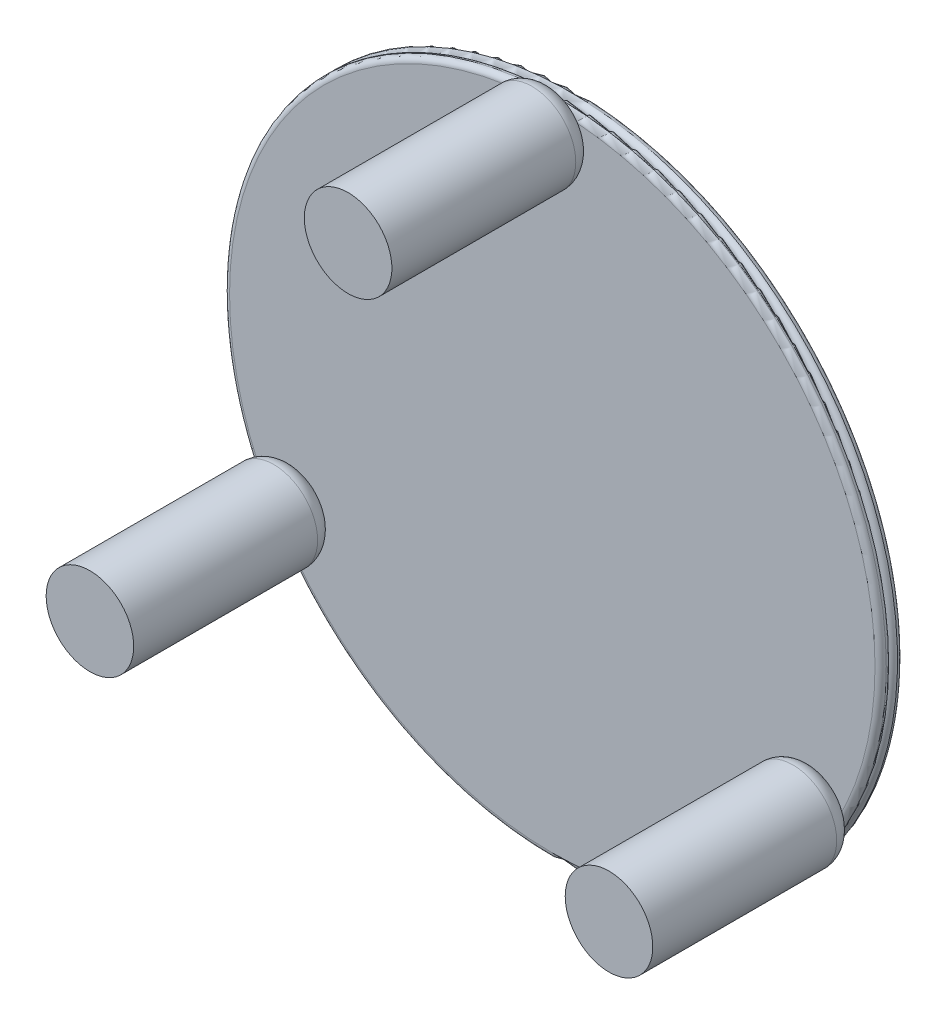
SolidWorks part; units mm, degrees
ref_plane "Front Plane" through (0, 0, 0) normal (0, 0, 1) x (1, 0, 0)
ref_plane "Top Plane" through (0, 0, 0) normal (0, 1, 0) x (1, 0, 0)
ref_plane "Right Plane" through (0, 0, 0) normal (1, 0, 0) x (0, 0, -1)
sketch "Sketch2" plane through (0, 0, 0) normal (0, 0, 1) x (1, 0, 0)
  circle A1 centre (-266.1198, 33.5976) radius 525
  dimension "D2" = 1050
extrude "Boss-Extrude1" add sketch "Sketch2" along normal blind 18
fillet "Fillet1" radius 9 2 edges at (258.8802, 33.5976, 0) (258.8802, 33.5976, 18)
sketch "Sketch3" plane through (0, 0, 0) normal (0, 0, -1) x (-1, 0, 0)
  circle A0 centre (266.1198, 33.5976) radius 525 construction
  circle A1 centre (266.1198, 33.5976) radius 525
extrude "Boss-Extrude2" add sketch "Sketch3" along normal blind 18 separate body
fillet "Fillet2" radius 9 2 edges at (-791.1198, 33.5976, 0) (-791.1198, 33.5976, -18)
sketch "Sketch4" plane through (0, 0, 18) normal (0, 0, 1) x (1, 0, 0)
  circle A0 centre (-268.5803, 522.7758) radius 70
  circle A1 centre (148.561, -208.1457) radius 70
  circle A2 centre (-681.3571, -207.1887) radius 70
  circle A3 centre (-266.1198, 33.5976) radius 525 construction
  point P6 (148.2557, -207.9677)
  point P7 (-682.7004, -207.9677)
  dimension "D1" = 140
  dimension "D2" = 140
  dimension "D3" = 140
  dimension "D4" = 480
  dimension "D5" = 480
  dimension "D6" = 489.1844
extrude "Boss-Extrude3" add sketch "Sketch4" along normal offset from surface (324 mm away) 360 separate body
fillet "Fillet3" radius 30 1 edges at (-611.3571, -207.1887, 18)
fillet "Fillet4" radius 30 1 edges at (218.561, -208.1457, 18)
fillet "Fillet5" radius 30 1 edges at (-198.5803, 522.7758, 18)
